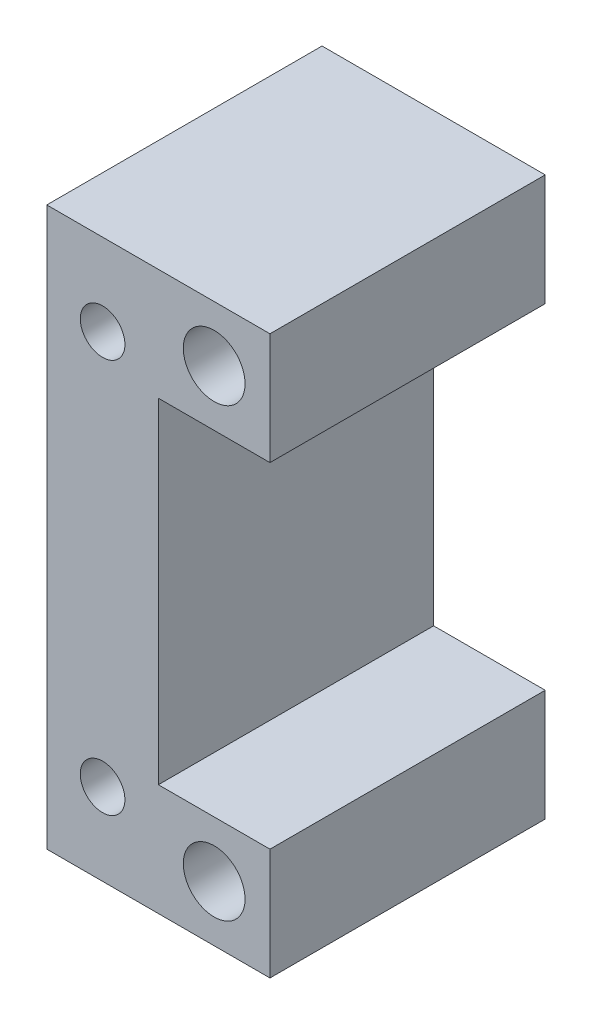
SolidWorks part; units mm, degrees
ref_plane "Plan de face" through (0, 0, 0) normal (0, 0, 1) x (1, 0, 0)
ref_plane "Plan de dessus" through (0, 0, 0) normal (0, 1, 0) x (1, 0, 0)
ref_plane "Plan de droite" through (0, 0, 0) normal (1, 0, 0) x (0, 0, -1)
sketch "Esquisse1" plane through (0, 0, 0) normal (0, 0, 1) x (1, 0, 0)
  line L0 (15, -75) -> (30, -75)
  line L1 (0, 0) -> (15, 0)
  line L2 (0, 0) -> (0, -75)
  line L3 (0, -75) -> (15, -75)
  line L4 (15, -15) -> (15, -60)
  line L5 (30, -75) -> (30, -60)
  line L6 (30, -60) -> (15, -60)
  line L7 (15, -15) -> (30, -15)
  line L8 (30, -15) -> (30, 0)
  line L9 (30, 0) -> (15, 0)
  dimension "D1" = 15
  dimension "D2" = 75
  dimension "D3" = 15
  dimension "D4" = 15
  dimension "D5" = 75
extrude "Boss.-Extru.1" add sketch "Esquisse1" along normal blind 37
sketch "Esquisse2" plane through (0, 0, 37) normal (0, 0, 1) x (1, 0, 0)
  line L0 (7.5, -11) -> (7.5, -64) construction
  line L1 (0, 0) -> (0, -75) construction
  line L4 (30, -60) -> (15, -60) construction
  line L5 (30, -75) -> (30, -60) construction
  line L6 (30, 0) -> (0, 0) construction
  circle A0 centre (7.5, -11) radius 3
  circle A1 centre (7.5, -64) radius 3
  circle A4 centre (22.5, -7.5) radius 4.15
  circle A5 centre (22.5, -67.5) radius 4.15
  point P6 (0, -37.5)
  point P7 (7.5, -37.5)
  dimension "D1" = 6
  dimension "D3" = 7.5
  dimension "D4" = 8.3
  dimension "D5" = 7.5
  dimension "D7" = 7.5
  dimension "D2" = 53
  dimension "D6" = 7.5
extrude "Enlèv. mat.-Extru.2" cut sketch "Esquisse2" against normal blind 37
sketch "Esquisse4" plane through (0, 0, 0) normal (-1, 0, 0) x (0, 0, 1)
  line L0 (0, 0) -> (0, -75) construction
  line L1 (0, -25) -> (20, -25)
  line L2 (0, -25) -> (0, -75)
  line L3 (0, -75) -> (20, -75)
  line L4 (20, -25) -> (20, -75)
  line L5 (37, -75) -> (0, -75) construction
  dimension "D1" = 50
  dimension "D2" = 20
sketch "Esquisse8" plane through (0, 0, 0) normal (0, 0, -1) x (-1, 0, 0)
  line L0 (-30, -75) -> (-30, -60) construction
  line L1 (-7.5, -58.2265) -> (-12.5, -61.1132)
  line L2 (-12.5, -61.1132) -> (-12.5, -66.8868)
  line L3 (-12.5, -66.8868) -> (-7.5, -69.7735)
  line L4 (-7.5, -69.7735) -> (-2.5, -66.8868)
  line L5 (-2.5, -66.8868) -> (-2.5, -61.1132)
  line L6 (-2.5, -61.1132) -> (-7.5, -58.2265)
  line L7 (-7.5, -5.2265) -> (-12.5, -8.1132)
  line L8 (-12.5, -8.1132) -> (-12.5, -13.8868)
  line L9 (-12.5, -13.8868) -> (-7.5, -16.7735)
  line L10 (-7.5, -16.7735) -> (-2.5, -13.8868)
  line L11 (-2.5, -13.8868) -> (-2.5, -8.1132)
  line L12 (-2.5, -8.1132) -> (-7.5, -5.2265)
  circle A0 centre (-7.5, -64) radius 5 construction
  circle A1 centre (-7.5, -11) radius 5 construction
  dimension "D1" = 10
  dimension "D2" = 10
extrude "Enlèv. mat.-Extru.6" cut sketch "Esquisse8" against normal blind 10
